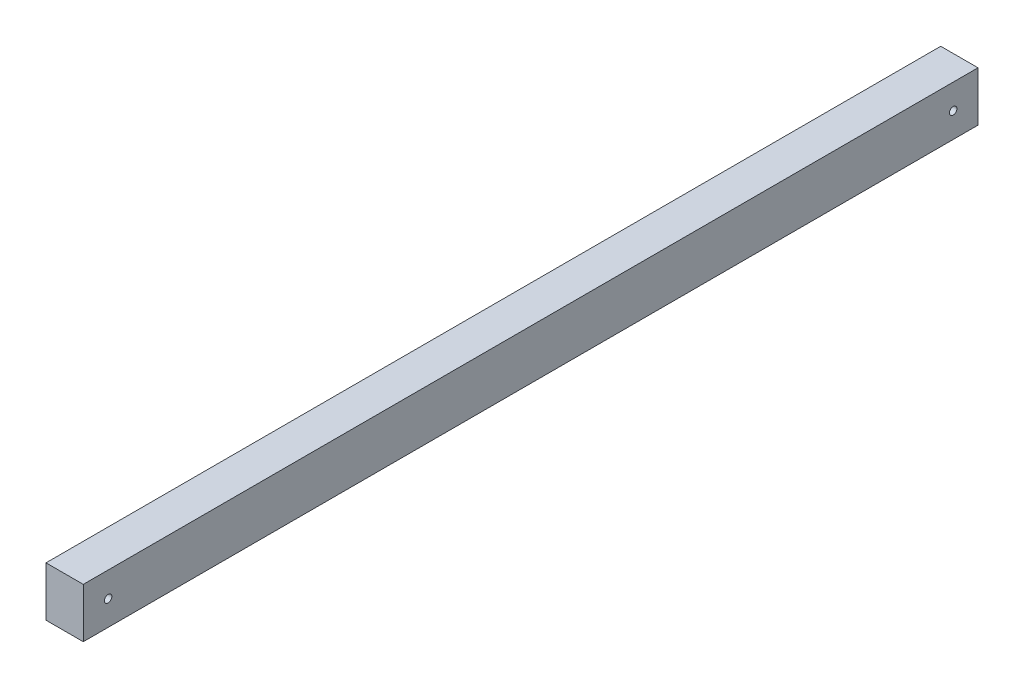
SolidWorks part; units mm, degrees
ref_plane "Plan de face" through (0, 0, 0) normal (0, 0, 1) x (1, 0, 0)
ref_plane "Plan de dessus" through (0, 0, 0) normal (0, 1, 0) x (1, 0, 0)
ref_plane "Plan de droite" through (0, 0, 0) normal (1, 0, 0) x (0, 0, -1)
sketch "Esquisse1" plane through (0, 0, 0) normal (0, 0, 1) x (1, 0, 0)
  line L1 (15, -20) -> (-15, -20)
  line L2 (15, -20) -> (15, 20)
  line L3 (15, 20) -> (-15, 20)
  line L4 (-15, -20) -> (-15, 20)
  line L5 (15, -20) -> (-15, 20) construction
  line L6 (15, 20) -> (-15, -20) construction
  point P0 (0, 0)
  dimension "D1" = 40
  dimension "D2" = 30
extrude "Boss.-Extru.1" add sketch "Esquisse1" along normal mid plane 720
sketch "Esquisse2" plane through (0, 0, 0) normal (1, 0, 0) x (0, 0, -1)
  line L0 (0, 0) -> (0, 96.2551) construction
  line L1 (-360, -20) -> (-360, 20) construction
  circle A0 centre (-340, 0) radius 3
  circle A1 centre (340, 0) radius 3
  dimension "D1" = 20
  dimension "D2" = 6
extrude "Enlèv. mat.-Extru.1" cut sketch "Esquisse2" against normal through all both and the other way through all
